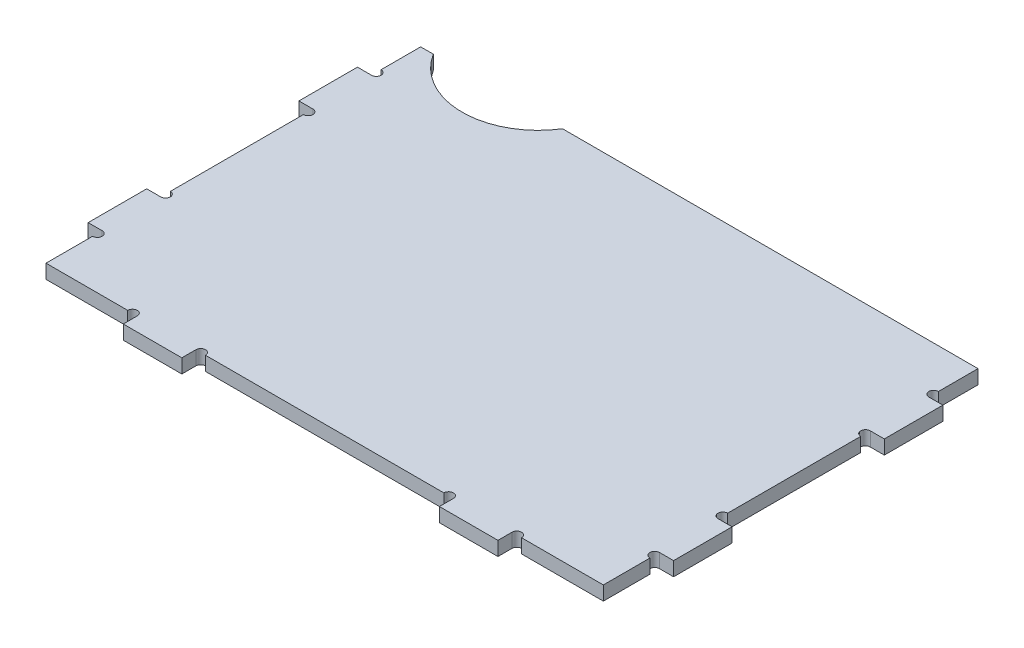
SolidWorks part; units mm, degrees
ref_plane "Спереди" through (0, 0, 0) normal (0, 0, 1) x (1, 0, 0)
ref_plane "Сверху" through (0, 0, 0) normal (0, 1, 0) x (1, 0, 0)
ref_plane "Справа" through (0, 0, 0) normal (1, 0, 0) x (0, 0, -1)
sketch "Sketch1" plane through (0, 0, 0) normal (0, 1, 0) x (1, 0, 0)
  line L0 (-101.8, 0) -> (101.8, 0)
  line L1 (110, 0) -> (110, -12)
  line L2 (110, -12) -> (160, -12)
  line L3 (160, -12) -> (160, 0)
  line L4 (168.2, 0) -> (238, 0)
  line L5 (238, 0) -> (238, 39.8)
  line L6 (238, 48) -> (250, 48)
  line L7 (250, 48) -> (250, 98)
  line L8 (250, 98) -> (238, 98)
  line L9 (238, 106.2) -> (238, 219.8)
  line L10 (238, 228) -> (250, 228)
  line L11 (250, 228) -> (250, 278)
  line L12 (250, 278) -> (238, 278)
  line L13 (238, 286.2) -> (238, 320)
  line L14 (238, 320) -> (-116.824, 320)
  line L15 (0, 320) -> (0, 0) construction
  line L16 (-238, 286.2) -> (-238, 320)
  line L17 (-250, 278) -> (-238, 278)
  line L18 (-250, 228) -> (-250, 278)
  line L19 (-238, 228) -> (-250, 228)
  line L20 (-238, 106.2) -> (-238, 219.8)
  line L21 (-250, 98) -> (-238, 98)
  line L22 (-250, 48) -> (-250, 98)
  line L23 (-238, 48) -> (-250, 48)
  line L24 (-238, 0) -> (-238, 39.8)
  line L25 (-168.2, 0) -> (-238, 0)
  line L26 (-160, -12) -> (-160, 0)
  line L27 (-110, -12) -> (-160, -12)
  line L28 (-110, 0) -> (-110, -12)
  line L29 (-238, 320) -> (-227.176, 320)
  arc A0 (110, 0) -> (101.8, 0) centre (105.9, 0) ccw
  arc A1 (160, 0) -> (168.2, 0) centre (164.1, 0) cw
  arc A2 (238, 48) -> (238, 39.8) centre (238, 43.9) ccw
  arc A3 (238, 98) -> (238, 106.2) centre (238, 102.1) cw
  arc A4 (238, 278) -> (238, 286.2) centre (238, 282.1) cw
  arc A5 (238, 228) -> (238, 219.8) centre (238, 223.9) ccw
  arc A6 (-238, 228) -> (-238, 219.8) centre (-238, 223.9) cw
  arc A7 (-238, 278) -> (-238, 286.2) centre (-238, 282.1) ccw
  arc A8 (-238, 98) -> (-238, 106.2) centre (-238, 102.1) ccw
  arc A9 (-238, 48) -> (-238, 39.8) centre (-238, 43.9) cw
  arc A10 (-160, 0) -> (-168.2, 0) centre (-164.1, 0) ccw
  arc A11 (-110, 0) -> (-101.8, 0) centre (-105.9, 0) cw
  arc A12 (-227.176, 320) -> (-116.824, 320) centre (-172, 354.36) ccw
  dimension "D3" = 4.1
  dimension "D9" = 66
  dimension "D10" = 65
  dimension "D1" = 12
  dimension "D2" = 90
  dimension "D4" = 50
  dimension "D5" = 250
  dimension "D6" = 60
  dimension "D7" = 240
  dimension "D8" = 320
  dimension "D11" = 34.36
extrude "Boss-Extrude1" add sketch "Sketch1" along normal blind 12
